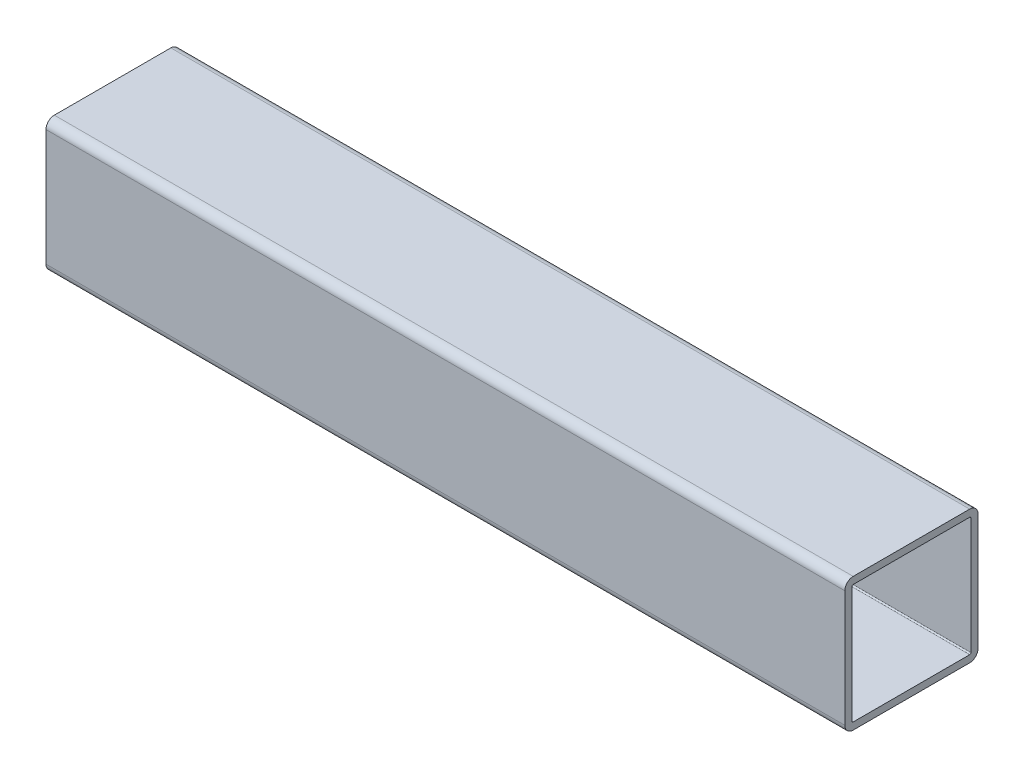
SolidWorks part; units mm, degrees
ref_plane "Front Plane" through (0, 0, 0) normal (0, 0, 1) x (1, 0, 0)
ref_plane "Top Plane" through (0, 0, 0) normal (0, 1, 0) x (1, 0, 0)
ref_plane "Right Plane" through (0, 0, 0) normal (1, 0, 0) x (0, 0, -1)
sketch "Sketch1" plane through (0, 0, 0) normal (1, 0, 0) x (0, 0, -1)
  line L0 (-5.373, 3.898) -> (16.852, 3.898)
  line L1 (-5.373, 5.2442) -> (16.852, 5.2442)
  line L2 (-6.9605, 3.6567) -> (-6.9605, -18.5683)
  line L3 (-5.373, -20.1558) -> (16.852, -20.1558)
  line L4 (18.4395, 3.6567) -> (18.4395, -18.5683)
  line L5 (17.0933, 3.6567) -> (17.0933, -18.5683)
  line L6 (-5.373, -18.8096) -> (16.852, -18.8096)
  line L7 (-5.6143, 3.6567) -> (-5.6143, -18.5683)
  arc A0 (16.852, 5.2442) -> (18.4395, 3.6567) centre (16.852, 3.6567) cw
  arc A1 (-6.9605, 3.6567) -> (-5.373, 5.2442) centre (-5.373, 3.6567) cw
  arc A2 (-5.373, -20.1558) -> (-6.9605, -18.5683) centre (-5.373, -18.5683) cw
  arc A3 (18.4395, -18.5683) -> (16.852, -20.1558) centre (16.852, -18.5683) cw
  arc A4 (16.852, 3.898) -> (17.0933, 3.6567) centre (16.852, 3.6567) cw
  arc A5 (17.0933, -18.5683) -> (16.852, -18.8096) centre (16.852, -18.5683) cw
  arc A6 (-5.373, -18.8096) -> (-5.6143, -18.5683) centre (-5.373, -18.5683) cw
  arc A7 (-5.6143, 3.6567) -> (-5.373, 3.898) centre (-5.373, 3.6567) cw
  point P6 (18.4395, 5.2442)
  point P9 (-6.9605, 5.2442)
  point P14 (18.4395, -20.1558)
  dimension "D3" = 1.5875
  dimension "D1" = 25.4
  dimension "D2" = 25.4
  dimension "D4" = 1.3462
extrude "Extrude1" add sketch "Sketch1" along normal blind 152.4
